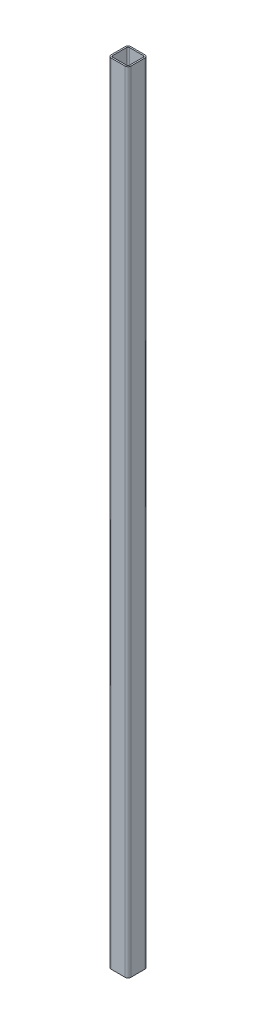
SolidWorks part; units mm, degrees
ref_plane "Plan de face" through (0, 0, 0) normal (0, 0, 1) x (1, 0, 0)
ref_plane "Plan de dessus" through (0, 0, 0) normal (0, 1, 0) x (1, 0, 0)
ref_plane "Plan de droite" through (0, 0, 0) normal (1, 0, 0) x (0, 0, -1)
sketch "Esquisse1" plane through (0, 0, 0) normal (0, 1, 0) x (1, 0, 0)
  line L1 (-7, -10) -> (7, -10)
  line L2 (-10, -7) -> (-10, 7)
  line L3 (-7, 10) -> (7, 10)
  line L4 (10, -7) -> (10, 7)
  arc A0 (-7, 10) -> (-10, 7) centre (-7, 7) ccw
  arc A1 (-7, -10) -> (-10, -7) centre (-7, -7) cw
  arc A2 (10, -7) -> (7, -10) centre (7, -7) cw
  arc A3 (10, 7) -> (7, 10) centre (7, 7) ccw
  point P4 (-10, 0)
  point P5 (0, 10)
  point P9 (-10, 10)
  point P12 (-10, -10)
  point P17 (10, 10)
  dimension "D3" = 3
  dimension "D1" = 20
  dimension "D2" = 20
extrude "Extru.-Mince1" add sketch "Esquisse1" along normal mid plane 800 thin
